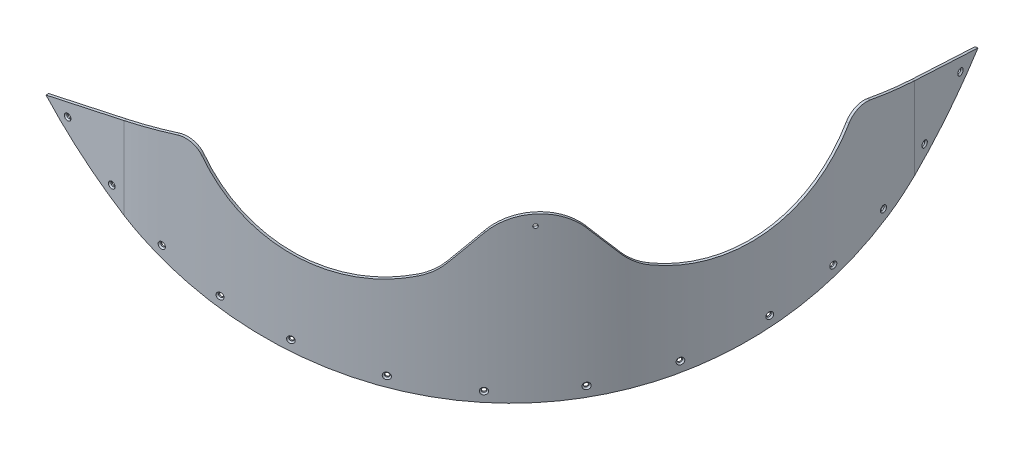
SolidWorks part; units mm, degrees
ref_plane "Face" through (0, 0, 0) normal (0, 0, 1) x (1, 0, 0)
ref_plane "Dessus" through (0, 0, 0) normal (0, 1, 0) x (1, 0, 0)
ref_plane "Droite" through (0, 0, 0) normal (1, 0, 0) x (0, 0, -1)
sketch "Esquisse1" plane through (0, 0, 0) normal (0, 0, 1) x (1, 0, 0)
  line L0 (54.2964, 53.0951) -> (94.2535, 10.6902)
  line L1 (406.3606, 101.3236) -> (599.9787, 59.3177)
  line L5 (-54.5465, 52.8381) -> (-94.7085, 11.3776)
  line L6 (-429.087, -55.369) -> (-427.6677, -52.7259) construction
  line L7 (0, 778) -> (-363.9183, 71.1044) construction
  line L8 (0, 778) -> (-355.7297, 86.4463) construction
  line L9 (0, 778) -> (-350.2026, -84.9984) construction
  line L10 (0, 778) -> (-265.5471, -114.6885) construction
  line L11 (0, 778) -> (-158.7935, -139.7106) construction
  line L12 (0, 778) -> (-42.1513, 63.17) construction
  line L13 (0, 778) -> (54.8234, -151.7325) construction
  line L14 (0, 778) -> (158.7935, -139.7106) construction
  line L15 (0, 778) -> (265.5471, -114.6885) construction
  line L16 (0, 778) -> (350.2026, -84.9984) construction
  line L18 (0, 778) -> (429.0408, -55.3932) construction
  line L19 (429.0408, -55.3932) -> (426.2945, -50.0586) construction
  line L20 (429.0408, -55.3932) -> (434.5335, -66.0624) construction
  line L22 (350.2026, -84.9984) -> (356.971, -101.6774) construction
  line L23 (265.5471, -114.6885) -> (270.6793, -131.9414) construction
  line L24 (158.7935, -139.7106) -> (161.8625, -157.447) construction
  line L25 (54.8234, -151.7325) -> (55.883, -169.7013) construction
  line L26 (-54.8234, -151.7325) -> (-55.883, -169.7013) construction
  line L27 (-158.7935, -139.7106) -> (-161.8625, -157.447) construction
  line L28 (-265.5471, -114.6885) -> (-270.6793, -131.9414) construction
  line L29 (-350.2026, -84.9984) -> (-356.971, -101.6774) construction
  line L31 (-429.0408, -55.3932) -> (-434.5335, -66.0624) construction
  line L32 (-599.9787, 59.3177) -> (-406.3606, 101.3236)
  line L33 (-426.2945, -50.0586) -> (-429.0408, -55.3932) construction
  line L34 (-498.8533, -6.3107) -> (-508.5136, -21.4988) construction
  line L35 (-565.4128, 49.2803) -> (-576.447, 35.059) construction
  line L44 (565.4128, 49.2803) -> (576.447, 35.059) construction
  line L45 (498.8533, -6.3107) -> (508.5136, -21.4988) construction
  circle A0 centre (-427.6677, -52.7259) radius 3
  arc A1 (94.2535, 10.6902) -> (123.8509, -8.0058) centre (148, 63) ccw
  arc A2 (-599.9787, 59.3177) -> (-434.5335, -66.0624) centre (-175.6677, 447.3707) ccw
  arc A3 (434.5335, -66.0624) -> (599.9787, 59.3177) centre (175.6677, 447.3707) ccw
  arc A4 (-126.1387, -7.9009) -> (-94.7085, 11.3776) centre (-148, 63) ccw
  arc A5 (123.8509, -8.0058) -> (373.9335, 86.8563) centre (191.4684, 190.8104) ccw
  arc A7 (54.2964, 53.0951) -> (-54.5465, 52.8381) centre (0, 0) ccw
  circle A8 centre (-351.3307, -87.7782) radius 3
  circle A9 centre (-266.4025, -117.564) radius 3
  circle A10 centre (-159.305, -142.6667) radius 3
  circle A11 centre (-55, -154.7273) radius 3
  circle A12 centre (55, -154.7273) radius 3
  circle A13 centre (159.305, -142.6667) radius 3
  circle A14 centre (266.4025, -117.564) radius 3
  circle A15 centre (351.3307, -87.7782) radius 3
  arc A16 (406.3606, 101.3236) -> (373.9335, 86.8563) centre (400, 72.0057) ccw
  circle A17 centre (427.6677, -52.7259) radius 3
  circle A18 centre (500.4633, -8.8421) radius 3
  circle A19 centre (567.2518, 46.9101) radius 3
  arc A20 (-434.5335, -66.0624) -> (434.5335, -66.0624) centre (0, 778) ccw
  arc A22 (-373.9858, 86.9477) -> (-126.1387, -7.9009) centre (-191.8865, 191.5414) ccw
  circle A25 centre (-500.4633, -8.8421) radius 3
  circle A26 centre (-567.2518, 46.9101) radius 3
  circle A29 centre (0, 60) radius 3
  arc A30 (-373.9858, 86.9477) -> (-406.3606, 101.3236) centre (-400, 72.0057) ccw
  dimension "D6" = 148
  dimension "D7" = 63
  dimension "D16" = 6
  dimension "D17" = 6
  dimension "D18" = 35
  dimension "D2" = 75
  dimension "D12" = 252
  dimension "D20" = 6
  dimension "D21" = 84
  dimension "D38" = 210
  dimension "D39" = 18
  dimension "D11" = 210
  dimension "D22" = 400
  dimension "D47" = 18
  dimension "D48" = 6
  dimension "D51" = 30
  dimension "D52" = 18
  dimension "D9" = 575
  dimension "D15" = 575
  dimension "D19" = 400
  dimension "D44" = 18
  dimension "D45" = 6
  dimension "D66" = 60
  dimension "D5" = 778
  dimension "D8" = 148
  dimension "D10" = 35
  dimension "D13" = 252
  dimension "D14" = 18
  dimension "D25" = 18
  dimension "D26" = 18
  dimension "D27" = 84
  dimension "D28" = 18
  dimension "D29" = 90
  dimension "D30" = 110
  dimension "D31" = 105
  dimension "D32" = 110
  dimension "D33" = 105
  dimension "D34" = 110
  dimension "D35" = 90
  dimension "D36" = 18
  dimension "D37" = 18
  dimension "D40" = 55
  dimension "D41" = 18
  dimension "D42" = 85
  dimension "D43" = 18
  dimension "D57" = 18
  dimension "D58" = 18
  dimension "D59" = 87
  dimension "D62" = 85
  dimension "D63" = 87
extrude "Extrusion1" add sketch "Esquisse1" along normal blind 4
sheet metal parameters "Tôlerie 1" parameters "D1"=500
flatten bends "Dépliage 1" parameters "D1"=500
sketch "Esquisse-Angle1" plane through (0, 0, 0) normal (0, 0, -1) x (-1, 0, 0)
process bends "Pliage 1" parameters "D1"=0
sketch "Esquisse-Plate1" plane through (0, 0, 0) normal (0, 0, -1) x (-1, 0, 0)
  line L0 (0, 75.942) -> (0, -171.3475)
  arc A0 (54.5465, 52.8381) -> (-54.2964, 53.0951) centre (0, 0) ccw construction
  arc A1 (-434.5335, -66.0624) -> (434.5335, -66.0624) centre (0, 778) ccw construction
  point P9 (45.6695, -57.1737)
  point P10 (45.6695, -57.1737)
bend "Pli défini à plat1" bend radius 550 bend angle 100 parameters "D5"=1
ref_plane "Plan1" through (-116.7016, 0, -133.2456) normal (0.6589, 0, 0.7523) x (0.7523, 0, -0.6589)
sketch "Esquisse2" plane through (-116.7016, 0, -133.2456) normal (0.6589, 0, 0.7523) x (0.7523, 0, -0.6589)
  line L0 (84.7335, 60.1256) -> (84.7335, -12.4968) construction
ref_plane "Plan2" through (71.2879, 0, -85.6022) normal (-0.6399, 0, 0.7684) x (0.7684, 0, 0.6399)
chamfer "Chanfrein1" distance 2 angle 45
